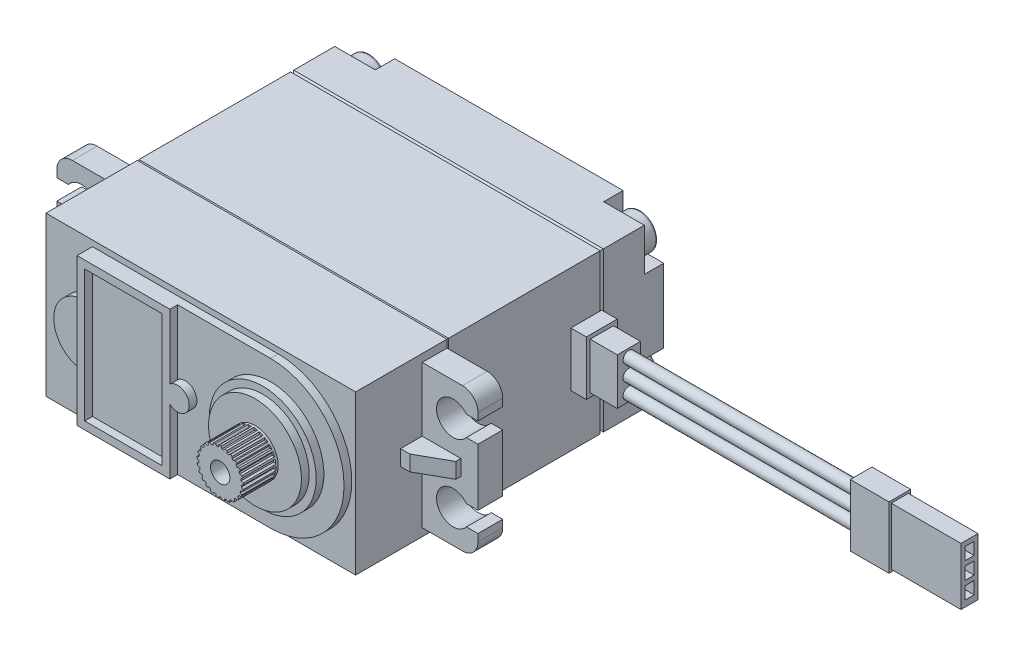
SolidWorks part; units mm, degrees
ref_plane "前视基准面" through (0, 0, 0) normal (0, 0, 1) x (1, 0, 0)
ref_plane "上视基准面" through (0, 0, 0) normal (0, 1, 0) x (1, 0, 0)
ref_plane "右视基准面" through (0, 0, 0) normal (1, 0, 0) x (0, 0, -1)
sketch "草图1" plane through (0, 0, 0) normal (0, 0, 1) x (1, 0, 0)
  line L1 (-20, 10.25) -> (20, 10.25)
  line L2 (-20, 10.25) -> (-20, -10.25)
  line L3 (-20, -10.25) -> (20, -10.25)
  line L4 (20, 10.25) -> (20, -10.25)
  dimension "D1" = 10.25
  dimension "D2" = 20.5
  dimension "D3" = 20
  dimension "D4" = 40
extrude "凸台-拉伸1" add sketch "草图1" along normal blind 8
chamfer "倒角1" distance 0.2 angle 45 4 edges at (0, 10.25, 8) (20, 0, 8) (0, -10.25, 8) (-20, 0, 8)
sketch "草图2" plane through (0, 0, 8) normal (0, 0, 1) x (1, 0, 0)
  line L0 (20, 10.25) -> (20, -10.25) construction
  line L1 (20, -10.25) -> (-20, -10.25) construction
  line L2 (-20, -10.25) -> (-20, 10.25) construction
  line L3 (-20, 10.25) -> (20, 10.25) construction
  line L4 (20, 10.25) -> (20, -10.25)
  line L5 (20, -10.25) -> (-20, -10.25)
  line L6 (-20, -10.25) -> (-20, 10.25)
  line L7 (-20, 10.25) -> (20, 10.25)
extrude "凸台-拉伸2" add sketch "草图2" along normal blind 20
chamfer "倒角4" distance 0.2 angle 45 4 edges at (-20, 0, 8) (0, 10.25, 8) (20, 0, 8) (0, -10.25, 8)
chamfer "倒角5" distance 0.2 angle 45 4 edges at (20, 0, 28) (0, -10.25, 28) (-20, 0, 28) (0, 10.25, 28)
sketch "草图3" plane through (0, 0, 28) normal (0, 0, 1) x (1, 0, 0)
  line L0 (20, 10.25) -> (20, -10.25) construction
  line L1 (20, -10.25) -> (-20, -10.25) construction
  line L2 (-20, -10.25) -> (-20, 10.25) construction
  line L3 (-20, 10.25) -> (20, 10.25) construction
  line L4 (20, 10.25) -> (20, -10.25)
  line L5 (20, -10.25) -> (-20, -10.25)
  line L6 (-20, -10.25) -> (-20, 10.25)
  line L7 (-20, 10.25) -> (20, 10.25)
extrude "凸台-拉伸3" add sketch "草图3" along normal blind 12.8
sketch "草图4" plane through (0, 0, 40.8) normal (0, 0, 1) x (1, 0, 0)
  line L0 (20, -10.25) -> (20, 10.25) construction
  circle A0 centre (10, 0) radius 6.9
  dimension "D1" = 10
  dimension "D2" = 13.8
extrude "凸台-拉伸4" add sketch "草图4" along normal blind 2
sketch "草图5" plane through (0, 0, 42.8) normal (0, 0, 1) x (1, 0, 0)
  circle A0 centre (10, 0) radius 3
  dimension "D1" = 6
extrude "凸台-拉伸5" add sketch "草图5" along normal blind 4.5
ref_plane "基准面1" through (0, 0, 28) normal (0, 0, 1) x (1, 0, 0)
sketch "草图8" plane through (0, 0, 28) normal (0, 0, 1) x (1, 0, 0)
  line L4 (-20, 10.25) -> (-20, -10.25) construction
  line L5 (-27.2, 9.25) -> (-27.2, 6.3)
  line L6 (20, -9.25) -> (27.2, -9.25)
  line L7 (-20, 9.25) -> (-20, -9.25)
  line L8 (-20, -9.25) -> (-27.2, -9.25)
  line L9 (-20, 9.25) -> (-27.2, 9.25)
  line L10 (27.2, -6.3) -> (27.2, -9.25)
  line L12 (25.7125, -6.3) -> (27.2, -6.3)
  line L13 (25.7125, -3.7) -> (27.2, -3.7)
  line L14 (-25.7125, 6.3) -> (-27.2, 6.3)
  line L15 (-25.7125, 3.7) -> (-27.2, 3.7)
  line L16 (-27.2, 3.7) -> (-27.2, -3.7)
  line L17 (27.2, 3.7) -> (27.2, -3.7)
  line L18 (-25.7125, -3.7) -> (-27.2, -3.7)
  line L19 (25.7125, 3.7) -> (27.2, 3.7)
  line L20 (-25.7125, -6.3) -> (-27.2, -6.3)
  line L21 (-27.2, -6.3) -> (-27.2, -9.25)
  line L22 (25.7125, 6.3) -> (27.2, 6.3)
  line L23 (27.2, 9.25) -> (27.2, 6.3)
  line L24 (20, 9.25) -> (20, -9.25)
  line L25 (20, 9.25) -> (27.2, 9.25)
  arc A0 (-25.7125, 3.7) -> (-25.7125, 6.3) centre (-24, 5) ccw
  arc A1 (-25.7125, -3.7) -> (-25.7125, -6.3) centre (-24, -5) cw
  arc A2 (25.7125, -3.7) -> (25.7125, -6.3) centre (24, -5) ccw
  arc A3 (25.7125, 3.7) -> (25.7125, 6.3) centre (24, 5) cw
  point P11 (-27.2, 10.25)
  point P12 (-27.2, -10.25)
  point P19 (-19.0859, 9.25)
  point P20 (-30.2671, 9.25)
  point P29 (-24, 6.3)
  point P31 (-29.7758, 6.3)
  point P32 (-24, 3.7)
  point P33 (-29.7758, 3.7)
  dimension "D5" = 4.3
extrude "凸台-拉伸6" add sketch "草图8" along normal blind 3.2
sketch "草图9" plane through (0, 0, 31.2) normal (0, 0, 1) x (1, 0, 0)
  line L5 (-25, -1) -> (-20, -1)
  line L6 (-25, 1) -> (-20, 1)
  line L7 (-20, -9.25) -> (-20, 9.25) construction
  line L8 (-20, -1) -> (-20, 1)
  line L10 (-25, -1) -> (-25, 1)
  line L12 (25, -1) -> (25, 1)
  line L13 (25, -1) -> (20, -1)
  line L14 (20, -1) -> (20, 1)
  line L15 (25, 1) -> (20, 1)
  line L18 (-20, -9.25) -> (-20, 9.25) construction
  line L19 (-25, -9.25) -> (-25, 9.25) construction
  point P0 (-27.2, 0)
  point P1 (-27.2, -1)
  point P2 (0.4483, -1)
  point P3 (0.4483, 0)
  point P6 (-27.2, 1)
  point P7 (0.4483, 1)
extrude "凸台-拉伸7" add sketch "草图9" along normal blind 2.8
sketch "草图10" plane through (0, -1, 0) normal (0, -1, 0) x (1, 0, 0)
  line L0 (-25, 31.8565) -> (-21.193, 34)
  line L1 (-25, 34) -> (-25, 31.2) construction
  line L2 (-25, 34) -> (-20, 34) construction
  line L3 (-21.193, 34) -> (-25, 34)
  line L4 (-25, 34) -> (-25, 31.8565)
  line L7 (25, 34) -> (25, 31.8565)
  line L8 (25, 31.8565) -> (21.193, 34)
  line L9 (21.193, 34) -> (25, 34)
extrude "切除-拉伸6" cut sketch "草图10" against normal blind 2.8
sketch "草图11" plane through (0, 0, 47.3) normal (0, 0, 1) x (1, 0, 0)
  circle A0 centre (10, 0) radius 1.25
  dimension "D1" = 2.5
extrude "切除-拉伸7" cut sketch "草图11" against normal blind 6
sketch "草图12" plane through (0, 0, 47.3) normal (0, 0, 1) x (1, 0, 0)
  line L1 (9.76, 2.7395) -> (9.88, 2.9976)
  line L2 (10.24, 2.7395) -> (10.12, 2.9976)
  line L3 (10.9137, 2.5938) -> (10.8617, 2.8736)
  line L4 (10.4488, 2.7131) -> (10.6292, 2.9333)
  line L5 (11.5301, 2.285) -> (11.5493, 2.569)
  line L6 (11.1095, 2.5163) -> (11.3389, 2.6846)
  line L7 (12.0503, 1.8327) -> (12.1395, 2.103)
  line L8 (11.7004, 2.1613) -> (11.9645, 2.2673)
  line L9 (12.4416, 1.2653) -> (12.5953, 1.5049)
  line L10 (12.1844, 1.6705) -> (12.4667, 1.7075)
  line L11 (12.6796, 0.6183) -> (12.888, 0.8122)
  line L12 (12.5313, 1.0748) -> (12.8138, 1.0404)
  line L13 (12.7492, -0.0675) -> (12.9992, 0.0685)
  line L14 (12.719, 0.4115) -> (12.9841, 0.308)
  line L15 (12.646, -0.7491) -> (12.922, -0.6796)
  line L16 (12.736, -0.2776) -> (12.967, -0.4438)
  line L17 (12.3766, -1.3836) -> (12.6612, -1.3849)
  line L18 (12.581, -0.9493) -> (12.7634, -1.1677)
  line L19 (11.9578, -1.9312) -> (12.2332, -2.0032)
  line L20 (12.2638, -1.5613) -> (12.3862, -1.8183)
  line L21 (11.4161, -2.3574) -> (11.6649, -2.4956)
  line L22 (11.8044, -2.0752) -> (11.859, -2.3546)
  line L23 (10.7853, -2.6355) -> (10.9919, -2.8313)
  line L24 (11.2316, -2.4588) -> (11.2151, -2.7429)
  line L25 (10.1052, -2.748) -> (10.2566, -2.989)
  line L26 (10.5815, -2.6878) -> (10.4948, -2.9589)
  line L27 (9.4185, -2.6878) -> (9.5052, -2.9589)
  line L28 (9.8948, -2.748) -> (9.7434, -2.989)
  line L29 (8.7684, -2.4588) -> (8.7849, -2.7429)
  line L30 (9.2147, -2.6355) -> (9.0081, -2.8313)
  line L31 (8.1956, -2.0752) -> (8.141, -2.3546)
  line L32 (8.5839, -2.3574) -> (8.3351, -2.4956)
  line L33 (7.7362, -1.5613) -> (7.6138, -1.8183)
  line L34 (8.0422, -1.9312) -> (7.7668, -2.0032)
  line L35 (7.419, -0.9493) -> (7.2366, -1.1677)
  line L36 (7.6234, -1.3836) -> (7.3388, -1.3849)
  line L37 (7.264, -0.2776) -> (7.033, -0.4438)
  line L38 (7.354, -0.7491) -> (7.078, -0.6796)
  line L39 (7.281, 0.4115) -> (7.0159, 0.308)
  line L40 (7.2508, -0.0675) -> (7.0008, 0.0685)
  line L41 (7.4687, 1.0748) -> (7.1862, 1.0404)
  line L42 (7.3204, 0.6183) -> (7.112, 0.8122)
  line L43 (7.8156, 1.6705) -> (7.5333, 1.7075)
  line L44 (7.5584, 1.2653) -> (7.4047, 1.5049)
  line L45 (8.2996, 2.1613) -> (8.0355, 2.2673)
  line L46 (7.9497, 1.8327) -> (7.8605, 2.103)
  line L47 (8.8905, 2.5163) -> (8.6611, 2.6846)
  line L48 (8.4699, 2.285) -> (8.4507, 2.569)
  line L49 (9.5512, 2.7131) -> (9.3708, 2.9333)
  line L50 (9.0863, 2.5938) -> (9.1383, 2.8736)
  arc A0 (9.76, 2.7395) -> (9.5512, 2.7131) centre (10, 0) ccw
  arc A1 (9.0863, 2.5938) -> (8.8905, 2.5163) centre (10, 0) ccw
  circle A2 centre (10, 0) radius 3 construction
  arc A3 (9.88, 2.9976) -> (9.3708, 2.9333) centre (10, 0) ccw
  arc A4 (9.1383, 2.8736) -> (8.6611, 2.6846) centre (10, 0) ccw
  arc A5 (8.4699, 2.285) -> (8.2996, 2.1613) centre (10, 0) ccw
  arc A6 (8.4507, 2.569) -> (8.0355, 2.2673) centre (10, 0) ccw
  arc A7 (7.9497, 1.8327) -> (7.8156, 1.6705) centre (10, 0) ccw
  arc A8 (7.8605, 2.103) -> (7.5333, 1.7075) centre (10, 0) ccw
  arc A9 (7.5584, 1.2653) -> (7.4687, 1.0748) centre (10, 0) ccw
  arc A10 (7.4047, 1.5049) -> (7.1862, 1.0404) centre (10, 0) ccw
  arc A11 (7.3204, 0.6183) -> (7.281, 0.4115) centre (10, 0) ccw
  arc A12 (7.112, 0.8122) -> (7.0159, 0.308) centre (10, 0) ccw
  arc A13 (7.2508, -0.0675) -> (7.264, -0.2776) centre (10, 0) ccw
  arc A14 (7.0008, 0.0685) -> (7.033, -0.4438) centre (10, 0) ccw
  arc A15 (7.354, -0.7491) -> (7.419, -0.9493) centre (10, 0) ccw
  arc A16 (7.078, -0.6796) -> (7.2366, -1.1677) centre (10, 0) ccw
  arc A17 (7.3388, -1.3849) -> (7.6138, -1.8183) centre (10, 0) ccw
  arc A18 (7.6234, -1.3836) -> (7.7362, -1.5613) centre (10, 0) ccw
  arc A19 (8.0422, -1.9312) -> (8.1956, -2.0752) centre (10, 0) ccw
  arc A20 (7.7668, -2.0032) -> (8.141, -2.3546) centre (10, 0) ccw
  arc A21 (8.5839, -2.3574) -> (8.7684, -2.4588) centre (10, 0) ccw
  arc A22 (8.3351, -2.4956) -> (8.7849, -2.7429) centre (10, 0) ccw
  arc A23 (9.2147, -2.6355) -> (9.4185, -2.6878) centre (10, 0) ccw
  arc A24 (9.0081, -2.8313) -> (9.5052, -2.9589) centre (10, 0) ccw
  arc A25 (9.8948, -2.748) -> (10.1052, -2.748) centre (10, 0) ccw
  arc A26 (9.7434, -2.989) -> (10.2566, -2.989) centre (10, 0) ccw
  arc A27 (10.5815, -2.6878) -> (10.7853, -2.6355) centre (10, 0) ccw
  arc A28 (10.4948, -2.9589) -> (10.9919, -2.8313) centre (10, 0) ccw
  arc A29 (11.2316, -2.4588) -> (11.4161, -2.3574) centre (10, 0) ccw
  arc A30 (11.2151, -2.7429) -> (11.6649, -2.4956) centre (10, 0) ccw
  arc A31 (11.8044, -2.0752) -> (11.9578, -1.9312) centre (10, 0) ccw
  arc A32 (11.859, -2.3546) -> (12.2332, -2.0032) centre (10, 0) ccw
  arc A33 (12.3862, -1.8183) -> (12.6612, -1.3849) centre (10, 0) ccw
  arc A34 (12.2638, -1.5613) -> (12.3766, -1.3836) centre (10, 0) ccw
  arc A35 (12.7634, -1.1677) -> (12.922, -0.6796) centre (10, 0) ccw
  arc A36 (12.581, -0.9493) -> (12.646, -0.7491) centre (10, 0) ccw
  arc A37 (12.967, -0.4438) -> (12.9992, 0.0685) centre (10, 0) ccw
  arc A38 (12.736, -0.2776) -> (12.7492, -0.0675) centre (10, 0) ccw
  arc A39 (12.9841, 0.308) -> (12.888, 0.8122) centre (10, 0) ccw
  arc A40 (12.719, 0.4115) -> (12.6796, 0.6183) centre (10, 0) ccw
  arc A41 (12.5313, 1.0748) -> (12.4416, 1.2653) centre (10, 0) ccw
  arc A42 (12.8138, 1.0404) -> (12.5953, 1.5049) centre (10, 0) ccw
  arc A43 (12.1844, 1.6705) -> (12.0503, 1.8327) centre (10, 0) ccw
  arc A44 (12.4667, 1.7075) -> (12.1395, 2.103) centre (10, 0) ccw
  arc A45 (11.7004, 2.1613) -> (11.5301, 2.285) centre (10, 0) ccw
  arc A46 (11.9645, 2.2673) -> (11.5493, 2.569) centre (10, 0) ccw
  arc A47 (11.1095, 2.5163) -> (10.9137, 2.5938) centre (10, 0) ccw
  arc A48 (11.3389, 2.6846) -> (10.8617, 2.8736) centre (10, 0) ccw
  arc A49 (10.4488, 2.7131) -> (10.24, 2.7395) centre (10, 0) ccw
  arc A50 (10.6292, 2.9333) -> (10.12, 2.9976) centre (10, 0) ccw
  point P111 (10, 0)
  dimension "D1" = 5.5
  dimension "D4" = 25
extrude "切除-拉伸8" cut sketch "草图12" against normal blind 4.2
sketch "草图13" plane through (0, 0, 40.8) normal (0, 0, 1) x (1, 0, 0)
  line L0 (10, 9.5) -> (-14, 9.5)
  line L1 (10, -9.5) -> (-14, -9.5)
  line L2 (20, -10.25) -> (20, 10.25) construction
  line L5 (-20, -10.25) -> (20, -10.25) construction
  line L6 (-14, 9.5) -> (-14, -9.5)
  line L7 (-20, 10.25) -> (-20, -10.25) construction
  line L8 (20, 10.25) -> (-20, 10.25) construction
  line L9 (20, -10.25) -> (20, 10.25)
  line L10 (-20, -10.25) -> (20, -10.25)
  line L11 (-20, 10.25) -> (-20, -10.25)
  line L12 (20, 10.25) -> (-20, 10.25)
  arc A0 (10, -9.5) -> (10, 9.5) centre (10, 0) ccw
  point P15 (-14, 10.25)
  point P16 (-14, -11.4768)
  dimension "D1" = 19
extrude "切除-拉伸9" cut sketch "草图13" against normal blind 1
fillet "圆角1" radius 2 4 edges at (27.2, 9.25, 29.6) (27.2, -9.25, 29.6) (-27.2, 9.25, 29.6) (-27.2, -9.25, 29.6)
sketch "草图17" plane through (20, 0, 0) normal (1, 0, 0) x (0, 0, -1)
  line L2 (-12, 3.5) -> (-8, 3.5)
  line L3 (-12, 3.5) -> (-12, -3.5)
  line L4 (-12, -3.5) -> (-8, -3.5)
  line L5 (-8, 3.5) -> (-8, -3.5)
  dimension "D2" = 7
  dimension "D3" = 3.5
  dimension "D4" = 4
extrude "凸台-拉伸8" add sketch "草图17" along normal blind 2
sketch "草图18" plane through (22, 0, 0) normal (1, 0, 0) x (0, 0, -1)
  line L8 (-11.5, 3) -> (-11.5, -3)
  line L9 (-11.5, -3) -> (-8.5, -3)
  line L10 (-8.5, -3) -> (-8.5, 3)
  line L11 (-8.5, 3) -> (-11.5, 3)
  line L12 (-11.5, 3) -> (-11.5, -3)
  line L13 (-11.5, -3) -> (-8.5, -3)
  line L14 (-8.5, -3) -> (-8.5, 3)
  line L15 (-8.5, 3) -> (-11.5, 3)
  dimension "D1" = 0.5
extrude "凸台-拉伸9" add sketch "草图18" along normal blind 3.5
sketch "草图19" plane through (25.5, 0, 0) normal (1, 0, 0) x (0, 0, -1)
  line L0 (-8.5, -3) -> (-8.5, 3) construction
  line L1 (-8.5, -3) -> (-8.5, 3) construction
  line L2 (-8.5, 3) -> (-11.5, 3) construction
  circle A0 centre (-10, 0) radius 0.75
  circle A1 centre (-10, 2) radius 0.75
  circle A2 centre (-10, -2) radius 0.75
  dimension "D1" = 1.5
  dimension "D2" = 1.5
  dimension "D3" = 1.5
  dimension "D4" = 1.5
  dimension "D5" = 1.5
  dimension "D6" = 1.5
  dimension "D7" = 1
  dimension "D8" = 2
  dimension "D9" = 2
extrude "凸台-拉伸10" add sketch "草图19" along normal blind 30
sketch "草图20" plane through (55.5, 0, 0) normal (1, 0, 0) x (0, 0, -1)
  line L1 (-11.4, 4) -> (-8.6, 4)
  line L2 (-11.4, 4) -> (-11.4, -4)
  line L3 (-11.4, -4) -> (-8.6, -4)
  line L4 (-8.6, 4) -> (-8.6, -4)
  circle A0 centre (-10, 2) radius 0.75 construction
  dimension "D1" = 8
  dimension "D2" = 2.8
  dimension "D3" = 1.4
  dimension "D4" = 4
extrude "凸台-拉伸11" add sketch "草图20" along normal blind 5
sketch "草图21" plane through (60.5, 0, 0) normal (1, 0, 0) x (0, 0, -1)
  line L5 (-10.59, 3.1) -> (-9.4, 3.1)
  line L6 (-10.59, 3.1) -> (-10.59, 1.5)
  line L7 (-10.59, 1.5) -> (-9.4, 1.5)
  line L8 (-11.1, 3.7) -> (-11.1, -3.7)
  line L9 (-11.1, -3.7) -> (-8.9, -3.7)
  line L10 (-8.9, -3.7) -> (-8.9, 3.7)
  line L11 (-8.9, 3.7) -> (-11.1, 3.7)
  line L12 (-11.1, 3.7) -> (-11.1, -3.7)
  line L13 (-11.1, -3.7) -> (-8.9, -3.7)
  line L14 (-8.9, -3.7) -> (-8.9, 3.7)
  line L15 (-8.9, 3.7) -> (-11.1, 3.7)
  line L16 (-9.4, 3.1) -> (-9.4, 1.5)
  line L17 (-10.59, 0.9) -> (-9.4, 0.9)
  line L18 (-10.59, 0.9) -> (-10.59, -0.7)
  line L19 (-10.59, -0.7) -> (-9.4, -0.7)
  line L20 (-9.4, 0.9) -> (-9.4, -0.7)
  line L21 (-10.59, -1.3) -> (-9.4, -1.3)
  line L22 (-10.59, -1.3) -> (-10.59, -2.9)
  line L23 (-10.59, -2.9) -> (-9.4, -2.9)
  line L24 (-9.4, -1.3) -> (-9.4, -2.9)
  dimension "D2" = 1.6
  dimension "D3" = 1.6
  dimension "D4" = 1.6
  dimension "D5" = 0.5
  dimension "D6" = 0.5
  dimension "D7" = 0.5
  dimension "D8" = 0.6
  dimension "D9" = 0.6
  dimension "D10" = 0.6
  dimension "D1" = 0.3
extrude "凸台-拉伸12" add sketch "草图21" along normal blind 9
sketch "草图22" plane through (0, 0, 0) normal (0, 0, -1) x (-1, 0, 0)
  line L5 (-20, 4.75) -> (-20, 10.25)
  line L6 (-20, 10.25) -> (-14.75, 10.25)
  line L7 (-17.5, -4.75) -> (-20, -4.75)
  line L8 (-14.75, -7.5) -> (-14.75, -10.25)
  line L9 (-20, -4.75) -> (-20, -10.25)
  line L11 (-20, -10.25) -> (-14.75, -10.25)
  line L12 (-14.75, 7.5) -> (-14.75, 10.25)
  line L13 (-17.5, 4.75) -> (-20, 4.75)
  line L14 (14.75, -7.5) -> (14.75, -10.25)
  line L15 (20, -10.25) -> (14.75, -10.25)
  line L16 (20, -4.75) -> (20, -10.25)
  line L17 (17.5, -4.75) -> (20, -4.75)
  line L18 (20, 4.75) -> (20, 10.25)
  line L19 (17.5, 4.75) -> (20, 4.75)
  line L20 (14.75, 7.5) -> (14.75, 10.25)
  line L21 (20, 10.25) -> (14.75, 10.25)
  arc A0 (-14.75, -7.5) -> (-17.5, -4.75) centre (-17.5, -7.5) ccw
  arc A1 (-14.75, 7.5) -> (-17.5, 4.75) centre (-17.5, 7.5) cw
  arc A2 (14.75, -7.5) -> (17.5, -4.75) centre (17.5, -7.5) cw
  arc A3 (14.75, 7.5) -> (17.5, 4.75) centre (17.5, 7.5) ccw
  dimension "D3" = 5.5
extrude "切除-拉伸13" cut sketch "草图22" against normal blind 2.5
sketch "草图23" plane through (0, 0, 2.5) normal (0, 0, -1) x (-1, 0, 0)
  line L4 (-17.25, -7.75) -> (-15.6165, -7.75)
  line L5 (-17.25, -7.25) -> (-15.6165, -7.25)
  line L6 (-17.25, 7.25) -> (-17.25, 5.6165)
  line L7 (-17.25, 7.75) -> (-15.6165, 7.75)
  line L8 (-17.25, -7.25) -> (-17.25, -5.6165)
  line L9 (-17.75, 7.25) -> (-17.75, 5.6165)
  line L10 (-17.75, -7.25) -> (-17.75, -5.6165)
  line L11 (-17.25, 7.25) -> (-15.6165, 7.25)
  line L12 (-19.3835, -7.25) -> (-17.75, -7.25)
  line L13 (-19.3835, -7.75) -> (-17.75, -7.75)
  line L14 (-17.75, -9.3835) -> (-17.75, -7.75)
  line L15 (-17.25, -9.3835) -> (-17.25, -7.75)
  line L16 (-19.3835, 7.25) -> (-17.75, 7.25)
  line L17 (-19.3835, 7.75) -> (-17.75, 7.75)
  line L18 (-17.25, 9.3835) -> (-17.25, 7.75)
  line L19 (-17.75, 9.3835) -> (-17.75, 7.75)
  line L20 (17.25, -7.25) -> (15.6165, -7.25)
  line L21 (17.25, -7.75) -> (15.6165, -7.75)
  line L22 (17.25, -9.3835) -> (17.25, -7.75)
  line L23 (17.75, -9.3835) -> (17.75, -7.75)
  line L24 (19.3835, -7.75) -> (17.75, -7.75)
  line L25 (19.3835, -7.25) -> (17.75, -7.25)
  line L26 (17.75, -7.25) -> (17.75, -5.6165)
  line L27 (17.25, -7.25) -> (17.25, -5.6165)
  line L28 (19.3835, 7.25) -> (17.75, 7.25)
  line L29 (17.75, 7.25) -> (17.75, 5.6165)
  line L30 (17.25, 7.25) -> (17.25, 5.6165)
  line L31 (17.25, 7.25) -> (15.6165, 7.25)
  line L32 (17.25, 7.75) -> (15.6165, 7.75)
  line L33 (17.25, 9.3835) -> (17.25, 7.75)
  line L34 (17.75, 9.3835) -> (17.75, 7.75)
  line L35 (19.3835, 7.75) -> (17.75, 7.75)
  circle A0 centre (-17.5, 7.5) radius 2.25
  arc A1 (-15.6165, 7.25) -> (-15.6165, 7.75) centre (-17.5, 7.5) ccw
  arc A2 (-17.75, 5.6165) -> (-17.25, 5.6165) centre (-17.5, 7.5) ccw
  arc A3 (-19.3835, 7.75) -> (-19.3835, 7.25) centre (-17.5, 7.5) ccw
  arc A4 (-17.25, 9.3835) -> (-17.75, 9.3835) centre (-17.5, 7.5) ccw
  arc A5 (-17.75, -5.6165) -> (-17.25, -5.6165) centre (-17.5, -7.5) cw
  arc A6 (-15.6165, -7.25) -> (-15.6165, -7.75) centre (-17.5, -7.5) cw
  arc A7 (-19.3835, -7.75) -> (-19.3835, -7.25) centre (-17.5, -7.5) cw
  arc A8 (-17.25, -9.3835) -> (-17.75, -9.3835) centre (-17.5, -7.5) cw
  circle A9 centre (-17.5, -7.5) radius 2.25
  arc A10 (15.6165, -7.25) -> (15.6165, -7.75) centre (17.5, -7.5) ccw
  arc A11 (17.25, -9.3835) -> (17.75, -9.3835) centre (17.5, -7.5) ccw
  arc A12 (19.3835, -7.75) -> (19.3835, -7.25) centre (17.5, -7.5) ccw
  arc A13 (17.75, -5.6165) -> (17.25, -5.6165) centre (17.5, -7.5) ccw
  circle A14 centre (17.5, -7.5) radius 2.25
  arc A15 (17.75, 5.6165) -> (17.25, 5.6165) centre (17.5, 7.5) cw
  arc A16 (19.3835, 7.75) -> (19.3835, 7.25) centre (17.5, 7.5) cw
  arc A17 (15.6165, 7.25) -> (15.6165, 7.75) centre (17.5, 7.5) cw
  arc A18 (17.25, 9.3835) -> (17.75, 9.3835) centre (17.5, 7.5) cw
  circle A19 centre (17.5, 7.5) radius 2.25
  point P8 (-19.75, 7.25)
  point P9 (-13.9428, 7.25)
  point P10 (-17.75, 9.75)
  point P11 (-17.75, 5.25)
  point P12 (-19.75, 7.75)
  point P13 (-13.9428, 7.75)
  point P14 (-17.25, 9.75)
  point P15 (-17.25, 5.25)
  dimension "D1" = 4.5
  dimension "D2" = 3.8
extrude "凸台-拉伸13" add sketch "草图23" along normal blind 2
fillet "圆角2" radius 0.3 4 edges at (-19.75, -7.5, 0.5) (19.75, -7.5, 0.5) (15.25, 7.5, 0.5) (-15.25, 7.5, 0.5)
sketch "草图25" plane through (0, 0, 40.8) normal (0, 0, 1) x (1, 0, 0)
  line L0 (-14, 9.5) -> (-14, -9.5) construction
  circle A0 centre (-14, 0) radius 4
  dimension "D1" = 8
extrude "凸台-拉伸15" add sketch "草图25" against normal blind 1
sketch "草图26" plane through (0, 0, 40.8) normal (0, 0, 1) x (1, 0, 0)
  line L0 (10, 9.5) -> (-14, 9.5) construction
  line L1 (-14, 9.5) -> (-2, 9.5)
  line L2 (-14, 9.5) -> (-14, -9.5)
  line L3 (-14, -9.5) -> (-2, -9.5)
  line L4 (-2, 9.5) -> (-2, -9.5)
  line L5 (-14, 9.5) -> (-14, 4) construction
  line L6 (-14, -9.5) -> (10, -9.5) construction
  line L7 (-13, 8.5) -> (-3, 8.5)
  line L8 (-3, 8.5) -> (-3, -8.5)
  line L9 (-13, -8.5) -> (-3, -8.5)
  line L10 (-13, 8.5) -> (-13, -8.5)
  dimension "D1" = 12
  dimension "D2" = 1
extrude "凸台-拉伸16" add sketch "草图26" along normal blind 1
sketch "草图27" plane through (0, 0, 42.8) normal (0, 0, 1) x (1, 0, 0)
  circle A0 centre (10, 0) radius 6
  circle A1 centre (10, 0) radius 6.9 construction
  circle A2 centre (10, 0) radius 6.9
  dimension "D1" = 12
extrude "切除-拉伸14" cut sketch "草图27" against normal blind 1
sketch "草图28" plane through (0, 0, 40.8) normal (0, 0, 1) x (1, 0, 0)
  circle A0 centre (-1, 0) radius 1.5
  circle A1 centre (10, 0) radius 3 construction
  dimension "D1" = 11
  dimension "D2" = 3
extrude "凸台-拉伸17" add sketch "草图28" along normal blind 1
